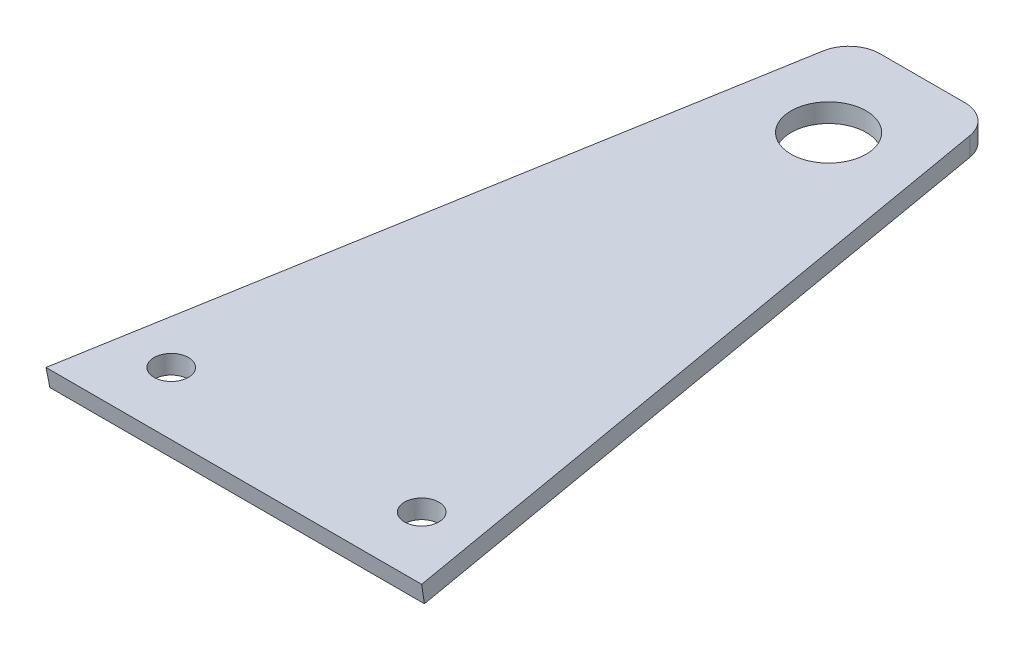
SolidWorks part; units mm, degrees
ref_plane "Front" through (0, 0, 0) normal (0, 0, 1) x (1, 0, 0)
ref_plane "Top" through (0, 0, 0) normal (0, 1, 0) x (1, 0, 0)
ref_plane "Right" through (0, 0, 0) normal (1, 0, 0) x (0, 0, -1)
sketch "Sketch1" plane through (0, 0, 0) normal (0, 1, 0) x (1, 0, 0)
  line L0 (18.2834, 105.851) -> (0, 0)
  line L1 (0, 0) -> (60, 0)
  line L3 (23.2104, 110) -> (36.7896, 110)
  line L5 (41.7166, 105.851) -> (60, 0)
  circle A0 centre (10, 10) radius 2.75
  circle A1 centre (50, 10) radius 2.75
  circle A2 centre (30, 95) radius 6
  arc A3 (18.2834, 105.851) -> (23.2104, 110) centre (23.2104, 105) cw
  arc A4 (41.7166, 105.851) -> (36.7896, 110) centre (36.7896, 105) ccw
extrude "Extrude1" add sketch "Sketch1" along normal blind 3
sketch "Sketch2" plane through (0, 0, 0) normal (1, 0, 0) x (0, 0, -1)
  line L0 (0, 3) -> (5.5774, -28.6311)
  line L1 (0, 3) -> (0, -26.3522)
  line L2 (5.5774, -28.6311) -> (0, -26.3522)
extrude "Cut-Extrude1" cut sketch "Sketch2" along normal through all
